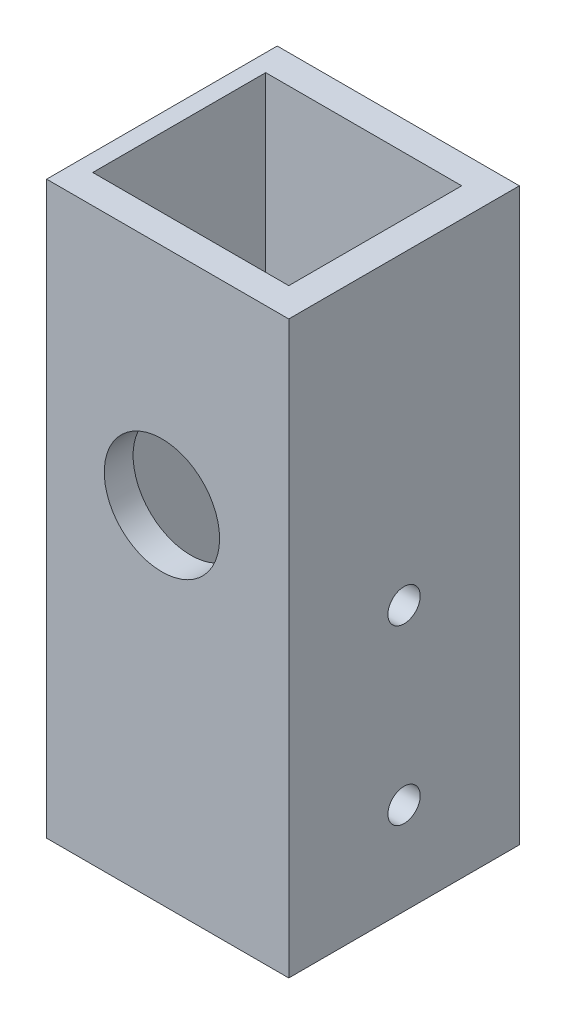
SolidWorks part; units mm, degrees
ref_plane "Front Plane" through (0, 0, 0) normal (0, 0, 1) x (1, 0, 0)
ref_plane "Top Plane" through (0, 0, 0) normal (0, 1, 0) x (1, 0, 0)
ref_plane "Right Plane" through (0, 0, 0) normal (1, 0, 0) x (0, 0, -1)
sketch "Sketch2" plane through (0, 0, 0) normal (0, 0, 1) x (1, 0, 0)
  line L1 (-7.5, 0) -> (7.5, 0)
  line L2 (-7.5, 0) -> (-7.5, -30)
  line L3 (-7.5, -30) -> (7.5, -30)
  line L4 (7.5, 0) -> (7.5, -30)
extrude "Boss-Extrude1" add sketch "Sketch2" along normal blind 3.5 contours L4 L3 L2 L1
sketch "Sketch4" plane through (7.5, 0, 0) normal (1, 0, 0) x (0, 0, -1)
  line L1 (-3.5, -30) -> (13, -30)
  line L2 (-3.5, -30) -> (-3.5, 0)
  line L3 (-3.5, 0) -> (13, 0)
  line L4 (13, -30) -> (13, 0)
extrude "Boss-Extrude2" add sketch "Sketch4" along normal blind 3.5
sketch "Sketch6" plane through (-7.5, 0, 0) normal (-1, 0, 0) x (0, 0, 1)
  line L1 (3.5, 0) -> (-13, 0)
  line L2 (3.5, 0) -> (3.5, -30)
  line L3 (3.5, -30) -> (-13, -30)
  line L4 (-13, 0) -> (-13, -30)
extrude "Boss-Extrude4" add sketch "Sketch6" along normal blind 3.5
sketch "Sketch7" plane through (0, 0, -13) normal (0, 0, -1) x (-1, 0, 0)
  line L1 (11, -30) -> (-11, -30)
  line L2 (11, -30) -> (11, 0)
  line L3 (11, 0) -> (-11, 0)
  line L4 (-11, -30) -> (-11, 0)
extrude "Boss-Extrude5" add sketch "Sketch7" along normal blind 3.5
sketch "Sketch8" plane through (0, 0, 0) normal (0, 1, 0) x (1, 0, 0)
  line L1 (7.5, 0) -> (-7.5, 0)
  line L2 (7.5, 0) -> (7.5, 13)
  line L3 (7.5, 13) -> (-7.5, 13)
  line L4 (-7.5, 0) -> (-7.5, 13)
  line L5 (11, -3.5) -> (-11, -3.5)
  line L6 (11, -3.5) -> (11, 16.5)
  line L7 (11, 16.5) -> (-11, 16.5)
  line L8 (-11, -3.5) -> (-11, 16.5)
extrude "Boss-Extrude6" add sketch "Sketch8" along normal blind 12
sketch "Sketch9" plane through (11, 0, 0) normal (1, 0, 0) x (0, 0, -1)
  line L0 (6.5, -30) -> (6.5, 12) construction
  line L1 (-3.5, -30) -> (16.5, -30) construction
  line L2 (-3.5, 12) -> (16.5, 12) construction
  circle A0 centre (6.5, -22) radius 1.4
  circle A1 centre (6.5, -7) radius 1.4
  point P8 (6.5, -7)
  dimension "D1" = 2.8
  dimension "D4" = 2.8
  dimension "D2" = 8
  dimension "D3" = 23
extrude "Cut-Extrude1" cut sketch "Sketch9" against normal blind 5
sketch "Sketch11" plane through (0, -30, 0) normal (0, -1, 0) x (1, 0, 0)
  line L0 (7.5, 0) -> (7.5, -13) construction
  line L1 (-8.5, 1) -> (8.5, 1)
  line L2 (-8.5, 1) -> (-8.5, -14)
  line L3 (-8.5, -14) -> (8.5, -14)
  line L4 (8.5, 1) -> (8.5, -14)
  line L5 (-8.5, 1) -> (8.5, -14) construction
  line L6 (-8.5, -14) -> (8.5, 1) construction
  line L7 (7.5, -13) -> (-7.5, -13) construction
  line L8 (-7.5, 0) -> (7.5, 0) construction
  line L9 (-7.5, -13) -> (-7.5, 0) construction
  point P0 (0, -6.5)
  dimension "D1" = 1
  dimension "D2" = 1
  dimension "D3" = 1
  dimension "D4" = 1
extrude "Cut-Extrude2" cut sketch "Sketch11" against normal blind 50
sketch "Sketch12" plane through (0, 0, 3.5) normal (0, 0, 1) x (1, 0, 0)
  circle A0 centre (0, 0) radius 5
  dimension "D1" = 10
extrude "Cut-Extrude3" cut sketch "Sketch12" against normal blind 10
sketch "Sketch13" plane through (0, 12, 0) normal (0, 1, 0) x (1, 0, 0)
  line L1 (-11, 16.5) -> (11, 16.5)
  line L2 (-11, 16.5) -> (-11, -3.5)
  line L3 (-11, -3.5) -> (11, -3.5)
  line L4 (11, 16.5) -> (11, -3.5)
  line L5 (-8.5, 14) -> (8.5, 14)
  line L6 (-8.5, 14) -> (-8.5, -1)
  line L7 (-8.5, -1) -> (8.5, -1)
  line L8 (8.5, 14) -> (8.5, -1)
extrude "Boss-Extrude7" add sketch "Sketch13" along normal blind 7.5
sketch "Sketch14" plane through (0, 19.5, 0) normal (0, 1, 0) x (1, 0, 0)
  line L0 (-11, -3.5) -> (11, -3.5) construction
  line L1 (-11, 16.5) -> (-10, 16.5)
  line L2 (-11, 16.5) -> (-11, -3.5)
  line L3 (-11, -3.5) -> (-10, -3.5)
  line L4 (-10, 16.5) -> (-10, -3.5)
  line L5 (-8.5, 14) -> (-8.5, -1) construction
  dimension "D1" = 1.5
extrude "Cut-Extrude4" cut sketch "Sketch14" against normal blind 50
